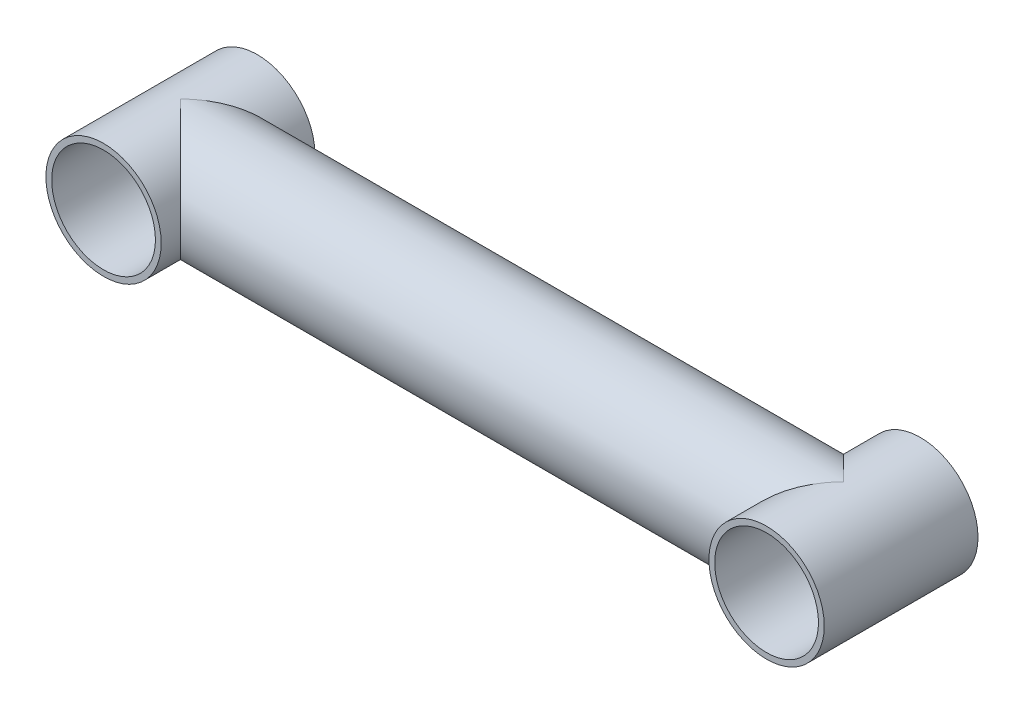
SolidWorks part; units mm, degrees
ref_plane "Plan de face" through (0, 0, 0) normal (0, 0, 1) x (1, 0, 0)
ref_plane "Plan de dessus" through (0, 0, 0) normal (0, 1, 0) x (1, 0, 0)
ref_plane "Plan de droite" through (0, 0, 0) normal (1, 0, 0) x (0, 0, -1)
sketch "Esquisse2" plane through (0, 0, 0) normal (1, 0, 0) x (0, 0, -1)
  circle A0 centre (0, 0) radius 30
  circle A1 centre (0, 0) radius 27
  dimension "D1" = 60
  dimension "D2" = 3
extrude "Boss.-Extru.1" add sketch "Esquisse2" against normal blind 345
sketch "Esquisse3" plane through (0, 0, 0) normal (0, 0, 1) x (1, 0, 0)
  line L0 (-345, 30) -> (-345, -30) construction
  circle A0 centre (0, 0) radius 30
  circle A1 centre (-345, 0) radius 30
  dimension "D1" = 60
extrude "Boss.-Extru.2" add sketch "Esquisse3" along normal mid plane 80
sketch "Esquisse4" plane through (0, 0, 40) normal (0, 0, 1) x (1, 0, 0)
  circle A0 centre (-345, 0) radius 27
  circle A1 centre (-345, 0) radius 30 construction
  circle A2 centre (0, 0) radius 27
  dimension "D1" = 3
extrude "Enlèv. mat.-Extru.1" cut sketch "Esquisse4" against normal through all
